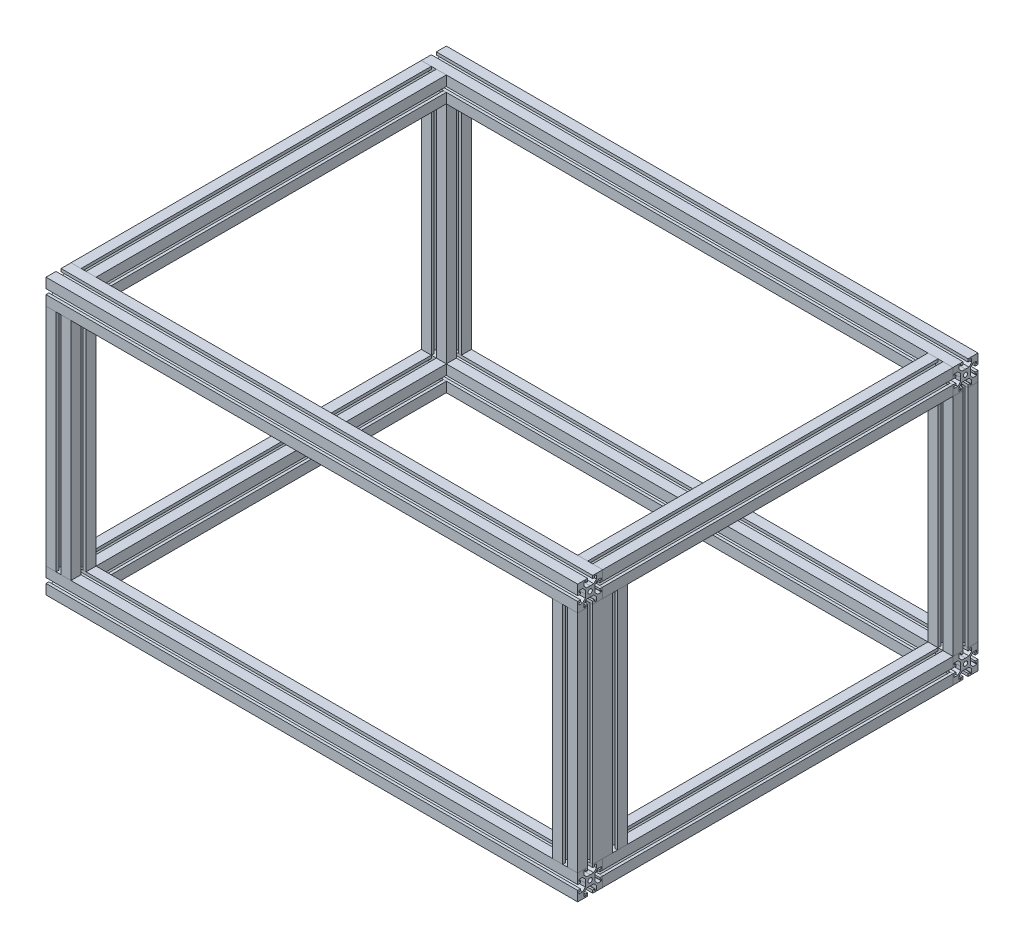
SolidWorks part; units mm, degrees
ref_plane "vorne" through (0, 0, 0) normal (0, 0, 1) x (1, 0, 0)
ref_plane "oben" through (0, 0, 0) normal (0, 1, 0) x (1, 0, 0)
ref_plane "rechts" through (0, 0, 0) normal (1, 0, 0) x (0, 0, -1)
sketch "Skizze119" plane through (0, 0, 0) normal (0, 1, 0) x (1, 0, 0)
  line L0 (0, 0) -> (0, -181.8676)
  line L1 (0, 0) -> (850, 0)
  line L2 (0, 0) -> (0, 600)
  line L3 (0, 600) -> (850, 600)
  line L4 (850, 0) -> (850, 600)
  line L5 (550, 0) -> (850, 0) construction
  line L6 (0, -181.8676) -> (164.1703, -181.8676)
  dimension "D1" = 850
  dimension "D2" = 600
  dimension "D4" = 300
ref_plane "Ebene15" through (0, 400, 0) normal (0, 1, 0) x (-1, 0, 0)
sketch "Skizze124" plane through (0, 400, 0) normal (0, 1, 0) x (-1, 0, 0)
  line L1 (0, -600) -> (-850, -600) construction
  line L2 (0, 0) -> (0, -600) construction
  line L3 (0, 0) -> (-850, 0) construction
  line L4 (-850, 0) -> (-850, -600)
  line L5 (0, -600) -> (-850, -600)
  line L6 (0, 0) -> (0, -600)
  line L7 (0, 0) -> (-850, 0)
  line L11 (-850, 0) -> (-850, -600) construction
ref_plane "Ebene16" through (20, 0, 0) normal (1, 0, 0) x (0, 0, -1)
sketch "Skizze126" plane through (20, 0, 0) normal (1, 0, 0) x (0, 0, -1)
  line L2 (0, 20) -> (0, 380)
  line L4 (600, 20) -> (600, 380)
  line L5 (20, 0) -> (580, 0)
  line L6 (20, 400) -> (580, 400)
  line L7 (50, 0) -> (-50, 0) construction
  line L8 (50, 400) -> (-50, 400) construction
  dimension "D1" = 20
  dimension "D2" = 20
  dimension "D3" = 20
  dimension "D4" = 20
ref_plane "Ebene17" through (830, 0, 0) normal (1, 0, 0) x (0, 0, -1)
sketch "Skizze127" plane through (830, 0, 0) normal (1, 0, 0) x (0, 0, -1)
  line L0 (600, 20) -> (600, 380) construction
  line L3 (0, 20) -> (0, 380) construction
  line L4 (600, 20) -> (600, 380)
  line L5 (20, 400) -> (580, 400) construction
  line L6 (20, 0) -> (580, 0) construction
  line L7 (0, 20) -> (0, 380)
  line L8 (20, 400) -> (580, 400)
  line L9 (20, 0) -> (580, 0)
  line L10 (20, 20) -> (20, 380)
  dimension "D1" = 20
sketch "Skizze128" plane through (0, 0, 0) normal (0, 0, 1) x (1, 0, 0)
  line L0 (180, 380) -> (180, 20)
  line L1 (570, 380) -> (570, 20)
  line L3 (0, 400) -> (850, 400) construction
  line L5 (0, 0) -> (850, 0) construction
  line L6 (810, 380) -> (810, 20)
  line L7 (830, 20) -> (830, 380) construction
  dimension "D1" = 180
  dimension "D2" = 20
  dimension "D3" = 20
  dimension "D4" = 20
  dimension "D5" = 20
other "Strukturbauteil2"
ref_plane "Ebene19" through (0, 0, -600) normal (1, 0, 0) x (0, 0, -1)
sketch "Skizze1"
  dimension "D3" = 6.8
  dimension "D1" = 40
  dimension "D2" = 40
  dimension "D4" = 20
  dimension "D5" = 20
other "Strukturbauteil3"
ref_plane "Ebene20" through (0, 400, 0) normal (1, 0, 0) x (0, 0, -1)
sketch "Skizze130"
  dimension "D3" = 6.8
  dimension "D1" = 40
  dimension "D2" = 40
  dimension "D4" = 20
  dimension "D5" = 20
other "Strukturbauteil4"
ref_plane "Ebene21" through (20, 400, -20) normal (0, 0, -1) x (-1, 0, 0)
sketch "Skizze131"
  dimension "D3" = 6.8
  dimension "D1" = 40
  dimension "D2" = 40
  dimension "D4" = 20
  dimension "D5" = 20
other "Strukturbauteil5"
ref_plane "Ebene22" through (830, 400, -20) normal (0, 0, -1) x (-1, 0, 0)
sketch "Skizze132"
  dimension "D3" = 6.8
  dimension "D1" = 40
  dimension "D2" = 40
  dimension "D4" = 20
  dimension "D5" = 20
other "Strukturbauteil6"
ref_plane "Ebene23" through (20, 20, 0) normal (0, 1, 0) x (-1, 0, 0)
sketch "Skizze133"
  dimension "D3" = 6.8
  dimension "D1" = 40
  dimension "D2" = 40
  dimension "D4" = 20
  dimension "D5" = 20
other "Strukturbauteil7"
ref_plane "Ebene24" through (830, 20, -600) normal (0, 1, 0) x (-1, 0, 0)
sketch "Skizze134"
  dimension "D3" = 6.8
  dimension "D1" = 40
  dimension "D2" = 40
  dimension "D4" = 20
  dimension "D5" = 20
other "Strukturbauteil8"
ref_plane "Ebene25" through (830, 20, -20) normal (0, 1, 0) x (-1, 0, 0)
sketch "Skizze136"
  dimension "D3" = 80
  dimension "D4" = 6.8
  dimension "D1" = 20
  dimension "D2" = 40
delete or keep bodies "Körper-Löschen2" type delete bodies bodies 150
